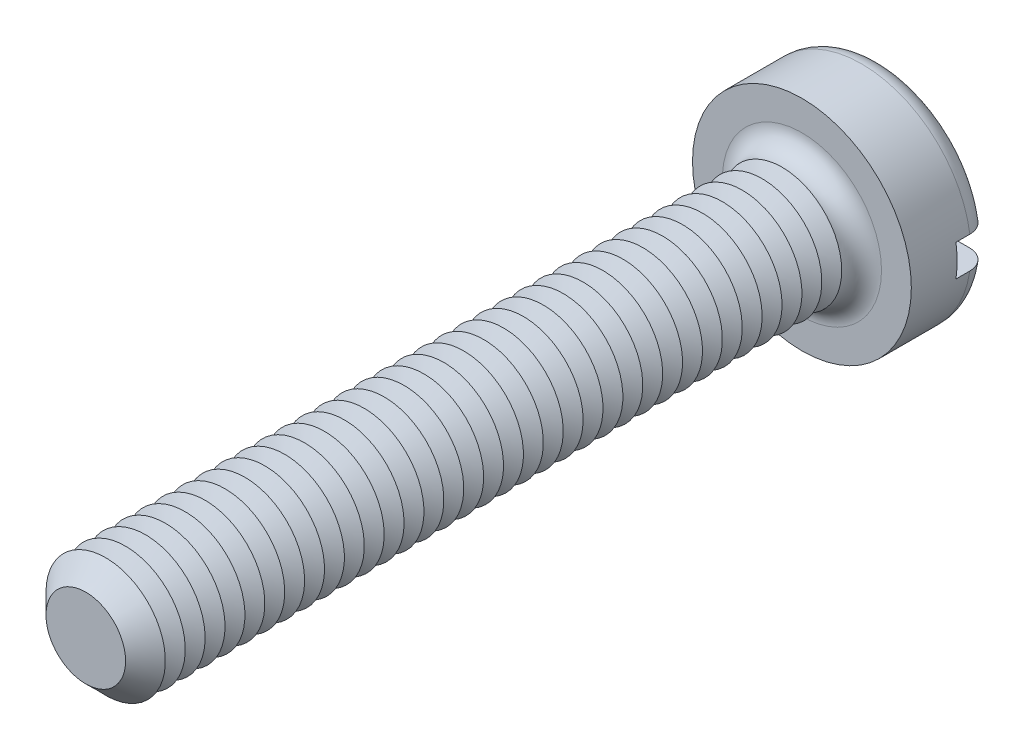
SolidWorks part; units mm, degrees
ref_plane "Front Plane" through (0, 0, 0) normal (0, 0, 1) x (1, 0, 0)
ref_plane "Top Plane" through (0, 0, 0) normal (0, 1, 0) x (1, 0, 0)
ref_plane "Right Plane" through (0, 0, 0) normal (1, 0, 0) x (0, 0, -1)
sketch "Sketch3" plane through (0, 0, 0) normal (0, 0, 1) x (1, 0, 0)
  circle A0 centre (0, 0) radius 2.75
  dimension "D1" = 5.5
extrude "Boss-Extrude2" add sketch "Sketch3" against normal blind 2
sketch "Sketch4" plane through (0, 0, 0) normal (0, 0, 1) x (1, 0, 0)
  circle A0 centre (0, 0) radius 1.5
  dimension "D1" = 3
extrude "Boss-Extrude3" add sketch "Sketch4" along normal blind 18
fillet "Fillet1" radius 0.5 2 edges at (2.75, 0, -2) (1.5, 0, 0)
chamfer "Chamfer1" distance 0.5 angle 45 1 edges at (1.5, 0, 18)
sketch "Sketch5" plane through (0, 0, 0) normal (1, 0, 0) x (0, 0, -1)
  line L0 (1.6944, 0) -> (-7.6738, 0) construction
sketch "Sketch6" plane through (0, 0, 0) normal (1, 0, 0) x (0, 0, -1)
  line L0 (-0.5, 1.5) -> (-0.75, 1.067)
  line L1 (-0.75, 1.067) -> (-1, 1.5)
  line L2 (-0.5, 1.5) -> (-17.5, 1.5) construction
  line L3 (-1, 1.5) -> (-0.5, 1.5)
  dimension "D1" = 0.5
revolve "Cut-Revolve1" cut sketch "Sketch6" angle 360 about L0
pattern_linear "LPattern1" count 34 spacing 0.5 along (0, 0, 1) of "Cut-Revolve1"
sketch "Sketch8" plane through (0, 0, -2) normal (0, 0, -1) x (-1, 0, 0)
  line L1 (2.75, -0.4) -> (-2.75, -0.4)
  line L2 (2.75, -0.4) -> (2.75, 0.4)
  line L3 (2.75, 0.4) -> (-2.75, 0.4)
  line L4 (-2.75, -0.4) -> (-2.75, 0.4)
  line L5 (2.75, -0.4) -> (-2.75, 0.4) construction
  line L6 (2.75, 0.4) -> (-2.75, -0.4) construction
  point P0 (0, 0)
  dimension "D1" = 5.5
  dimension "D2" = 0.8
extrude "Cut-Extrude1" cut sketch "Sketch8" against normal blind 0.85
